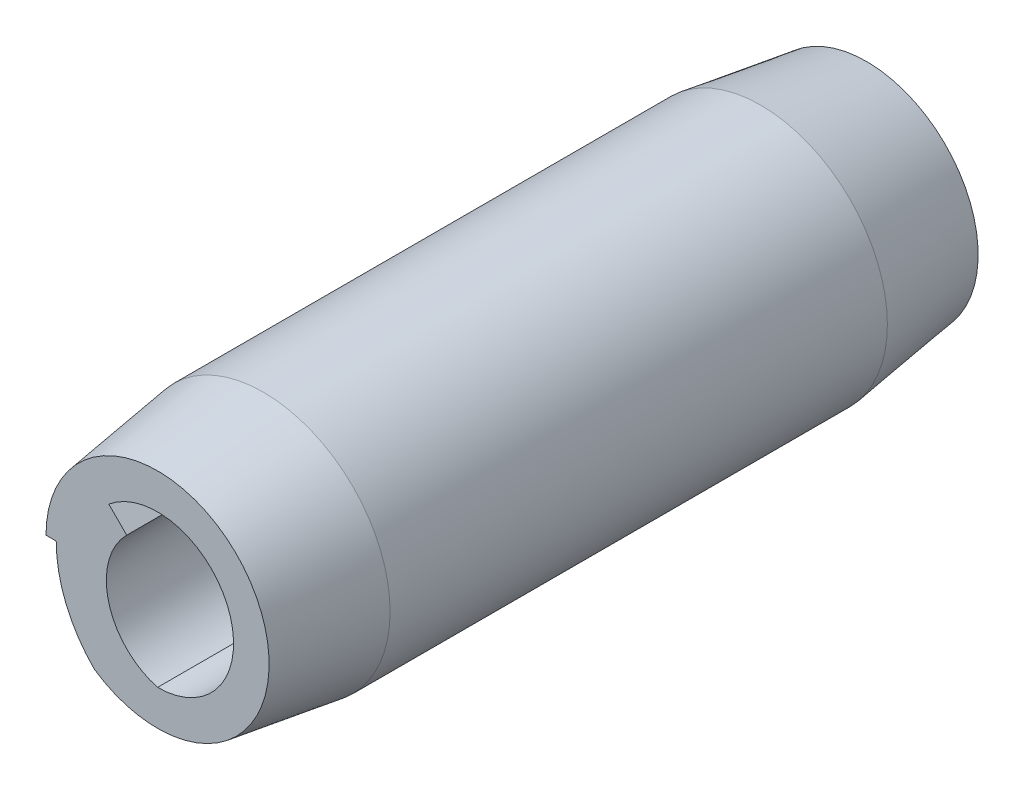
SolidWorks part; units mm, degrees
ref_plane "Plane1" through (0, 0, 0) normal (0, 0, 1) x (1, 0, 0)
ref_plane "Plane2" through (0, 0, 0) normal (0, 1, 0) x (1, 0, 0)
ref_plane "Plane3" through (0, 0, 0) normal (1, 0, 0) x (0, 0, -1)
sketch "Sketch1" plane through (0, 0, 0) normal (0, 0, 1) x (1, 0, 0)
  line L0 (0.936, 0) -> (-0.936, 0) construction
  line L1 (0, -0.9477) -> (0, 0.9477) construction
  line L2 (-0.8509, 0) -> (-0.6807, 0)
  line L3 (-0.6807, 0) -> (-0.5105, 0) construction
  line L4 (-0.3275, 0.3917) -> (-0.2071, 0.2713)
  line L5 (-0.5105, 0) -> (-0.3404, 0) construction
  arc A0 (-0.8509, 0) -> (0, -0.8509) centre (0, 0) cw
  arc A1 (-0.6807, 0) -> (0, -0.6807) centre (0, 0) cw construction
  arc A2 (0, -0.8509) -> (-0.6807, 0) centre (0.1915, 0) cw
  arc A3 (-0.5105, 0) -> (-0.3275, 0.3917) centre (0, 0) cw construction
  arc A4 (0, -0.5105) -> (-0.2071, 0.2713) centre (0.1236, -0.0594) cw
  arc A5 (-0.3275, 0.3917) -> (0, -0.5105) centre (0, 0) cw
  circle A6 centre (0, 0) radius 0.7493 construction
extrude "Boss-Extrude1" add sketch "Sketch1" along normal mid plane 4.7625
sketch "ChamferSke" plane through (0, 0, 0) normal (1, 0, 0) x (0, 0, -1)
  line L0 (-2.3813, 1.4677) -> (-2.3813, 0.7493)
  line L1 (-2.3813, 0.7493) -> (-1.6701, 0.8509)
  line L2 (-1.6701, 0.8509) -> (1.6701, 0.8509)
  line L3 (1.6701, 0.8509) -> (2.3813, 0.7493)
  line L4 (2.3813, 0.7493) -> (2.3813, 1.4677)
  line L5 (2.3813, 1.4677) -> (-2.3813, 1.4677)
  line L7 (0, 0) -> (-2.3813, 0) construction
revolve "Chamfer" cut sketch "ChamferSke" angle 360 about L7
equation "\"D1@Sketch1\"=\"Diameter@Sketch1\"/10"
equation "\"D1@ChamferSke\" = \"ChamferB@Sketch1\""
equation "\"D2@ChamferSke\" = \"Diameter@Sketch1\""
